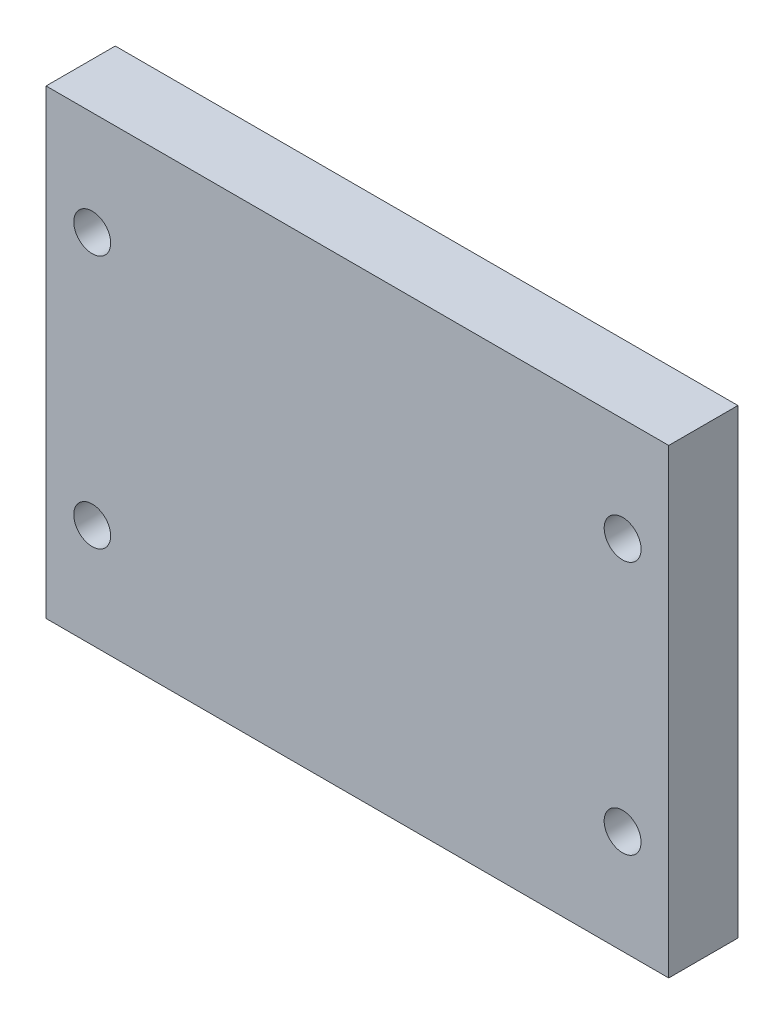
SolidWorks part; units mm, degrees
ref_plane "Plan de face" through (0, 0, 0) normal (0, 0, 1) x (1, 0, 0)
ref_plane "Plan de dessus" through (0, 0, 0) normal (0, 1, 0) x (1, 0, 0)
ref_plane "Plan de droite" through (0, 0, 0) normal (1, 0, 0) x (0, 0, -1)
sketch "Esquisse1" plane through (0, 0, 0) normal (0, 0, 1) x (1, 0, 0)
  line L1 (-35.4811, 18.8243) -> (18.5189, 18.8243)
  line L2 (-35.4811, 18.8243) -> (-35.4811, -21.1757)
  line L3 (-35.4811, -21.1757) -> (18.5189, -21.1757)
  line L4 (18.5189, 18.8243) -> (18.5189, -21.1757)
  circle A0 centre (-31.4811, 9.8243) radius 1.6
  circle A1 centre (14.5189, 9.8243) radius 1.6
  circle A2 centre (14.5189, -12.1757) radius 1.6
  circle A3 centre (-31.4811, -12.1757) radius 1.6
  dimension "D3" = 3.2
  dimension "D7" = 9
  dimension "D8" = 9
  dimension "D1" = 54
  dimension "D2" = 40
  dimension "D4" = 4
  dimension "D5" = 9
  dimension "D6" = 9
extrude "Boss.-Extru.1" add sketch "Esquisse1" along normal blind 6
